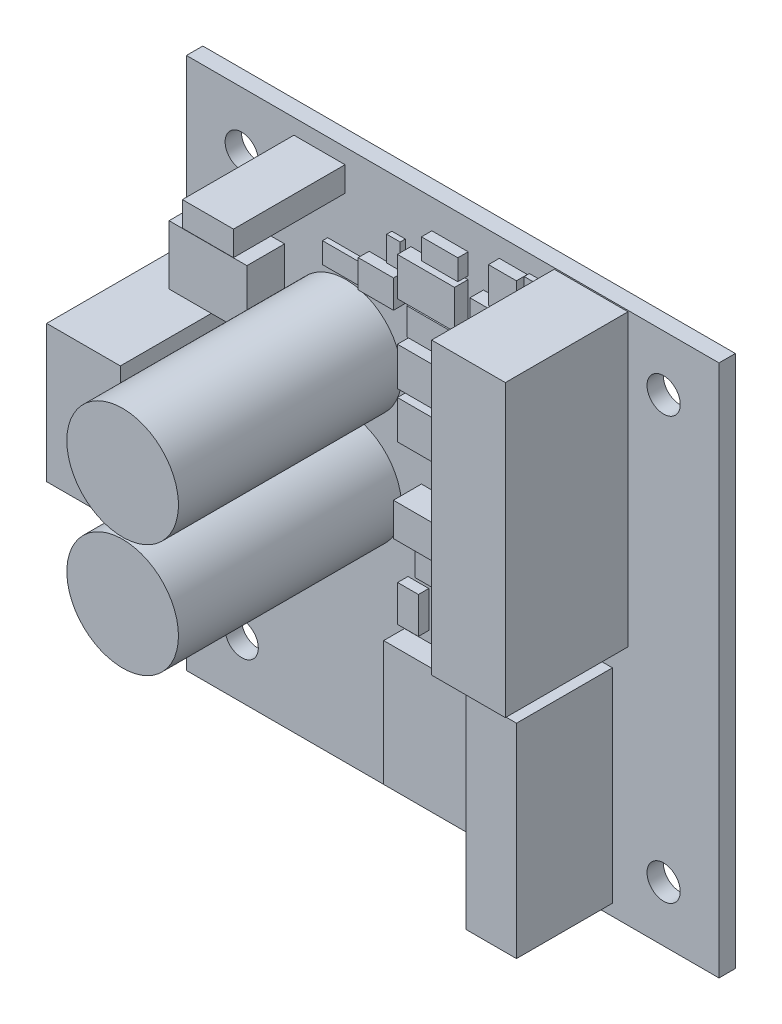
SolidWorks part; units mm, degrees
ref_plane "Front Plane" through (0, 0, 0) normal (0, 0, 1) x (1, 0, 0)
ref_plane "Top Plane" through (0, 0, 0) normal (0, 1, 0) x (1, 0, 0)
ref_plane "Right Plane" through (0, 0, 0) normal (1, 0, 0) x (0, 0, -1)
imported_body "10020689ra1_valve_actuator-1-surface1" [suppressed]
imported_body "MOLEX_705434PIN_705430003-1-surface1" [suppressed]
imported_body "MOLEX_705434PIN_705430003-2-surface1"
imported_body "RESC3225X60N_CRCW121051R0JNEA-1-surface1"
imported_body "TE_872242PIN_872242_SYMMOD1-1-surface1"
imported_body "TE_872242PIN_872242_SYMMOD1-2-surface1"
imported_body "SOIC127P594X3638N_HCPL0701-1-surface1"
imported_body "RESC2012X50N_CRCW0805100RJNEA-1-surface1"
imported_body "RESC2012X50N_CRCW0805100RJNEA-2-surface1"
imported_body "RESC2012X50N_CRCW0805100RJNEA-3-surface1"
imported_body "SOT65P205X1053N_132_BSS138W7F-1-surface1"
imported_body "SOT65P205X1053N_132_BSS138W7F-2-surface1"
imported_body "SOT65P205X1053N_132_BSS138W7F-3-surface1"
imported_body "SOP50P310X908N_SN74AUP1G74DCUR-1-surface1"
imported_body "SOP65P400X1308N_SN74AUP1G99DCTR_SYMMOD2-1-surface1"
imported_body "SOP65P400X1308N_SN74AUP1G99DCTR_SYMMOD2-2-surface1"
imported_body "SOP65P400X1308N_SN74AUP1G99DCTR_SYMMOD2-3-surface1"
imported_body "SOP65P400X1308N_SN74AUP1G99DCTR_SYMMOD3-1-surface1"
imported_body "SOP65P400X1308N_SN74AUP1G99DCTR_SYMMOD1-1-surface1"
imported_body "SOT65P280X1008N_LTC2934ITS81#TRMPBF-1-surface1"
imported_body "SOT65P280X1008N_LT3008ETS833#TRMPBF-1-surface1"
imported_body "DIOM5336X262N_SMBJ22A13F-1-surface1"
imported_body "DIOM5336X262N_SMBJ50A13F-1-surface1"
imported_body "DIOM5336X262N_SMBJ50A13F-2-surface1"
imported_body "CAPC1608X87N_C0603C104K5RAC-1-surface1"
imported_body "CAPC1608X87N_C0603C104K5RAC-2-surface1"
imported_body "CAPC1608X87N_C0603C104K5RAC-3-surface1"
imported_body "CAPC1608X87N_C0603C104K5RAC-4-surface1"
imported_body "SOT95P280X1005N_LT6003HS5#TRMPBF-1-surface1"
imported_body "CAPC2012X100N_C0805C105K4RAC-1-surface1"
imported_body "CAPC2012X100N_C0805C105K4RAC-2-surface1"
imported_body "CAPC2012X100N_C0805C105K4RAC-3-surface1"
imported_body "CAPC2012X100N_C0805C105K4RAC-4-surface1"
imported_body "CAPC2012X100N_C0805C105K4RAC-5-surface1"
imported_body "SOT92P240X120R3N_ACX_BAS197F-1-surface1"
imported_body "SOT92P240X120R3N_ACX_BAS197F-2-surface1"
imported_body "SOT92P240X120R3N_ACX_ZLLS1000TA-1-surface1"
imported_body "IND_MSS6132_MSS6132183MLB-1-surface1"
imported_body "CAPC2012X110N_C0805C474K5RAC-1-surface1"
imported_body "RESC1608X50N_CRCW060336K0JNEA-1-surface1"
imported_body "RESC1608X50N_CRCW060336K0JNEA-2-surface1"
imported_body "RESC1608X50N_CRCW060336K0JNEA-3-surface1"
imported_body "RESC1608X50N_CRCW0603330KJNEA-1-surface1"
imported_body "RESC1608X50N_CRCW06031M00JNEA-1-surface1"
imported_body "RESC1608X50N_CRCW060310K0JNEA-1-surface1"
imported_body "RESC1608X50N_CRCW060310K0JNEA-2-surface1"
imported_body "RESC1608X50N_CRCW0603154KFKEA-1-surface1"
imported_body "RESC1608X50N_CRCW06031M00FKEA-1-surface1"
imported_body "RESC1608X50N_CRCW06031M00FKEA-2-surface1"
imported_body "RESC1608X50N_CRCW06031M00FKEA-3-surface1"
imported_body "RESC1608X50N_CRCW06031M00FKEA-4-surface1"
imported_body "RESC1608X50N_CRCW060342K2FKEA-1-surface1"
imported_body "RESC1608X50N_CRCW06030000Z0EA-1-surface1"
imported_body "RESC1608X50N_CRCW0603100RJNEA-1-surface1"
imported_body "RESC1608X50N_CRCW0603562KFKEA-1-surface1"
imported_body "RESC1608X50N_CRCW060335K7FKEA-1-surface1"
imported_body "SOP50P490X11011N_MSEG_LT3991EMSE5#PBF-1-surface1"
imported_body "DIOM5336X250N_S1AB13F-1-surface1"
imported_body "IND_ACM4520_ACM45209012PT000-1-surface1"
imported_body "CAPC3325X270N_C1210X475K5RACTU-1-surface1"
imported_body "CAPC3325X270N_C1210X475K5RACTU-2-surface1"
imported_body "CAPC3325X270N_C1210X475K5RACTU-3-surface1"
imported_body "INDC1608X95N_MMZ1608S601A-1-surface1"
imported_body "CAPPRD500W60D1000H2150P_ESHSR0005C0002R7-1-surface1"
imported_body "CAPPRD500W60D1000H2150P_ESHSR0005C0002R7-2-surface1"
imported_body "TO127P1054X2008N_BD6212HFPTR-1-surface1"
imported_body "MOLEX_7054310PIN_0705430009-1-surface1"
imported_body "TE_14450945PIN_214450945-1-surface1"
imported_body "SOT95P280X1453N_132_SL353LT-1-surface1" [suppressed]
imported_body "SOT95P280X1453N_132_SL353LT-2-surface1" [suppressed]
sketch "Sketch3" plane through (0, 0, 0) normal (0, 0, 1) x (1, 0, 0)
  line L0 (28.956, 15.9893) -> (28.956, 0)
  line L1 (28.956, 0) -> (0, 0)
  line L16 (9.1313, 25.908) -> (9.1313, 41.783)
  line L17 (9.1313, 41.783) -> (0, 41.783)
  line L18 (0, 41.783) -> (0, 0)
  line L23 (28.956, 15.9893) -> (19.05, 15.9893)
  circle A1 centre (4.6736, 13.9954) radius 1.6002
  arc A2 (9.1313, 25.908) -> (19.05, 15.9893) centre (19.05, 25.908) ccw
  circle A4 centre (4.6736, 37.8206) radius 1.6002
  circle A9 centre (22.225, 2.667) radius 0.5461
  circle A10 centre (19.685, 2.667) radius 0.5461
  circle A11 centre (17.145, 2.667) radius 0.5461
  circle A12 centre (14.605, 2.667) radius 0.5461
extrude "Boss-Extrude2" [suppressed] add sketch "Sketch3" along normal blind 1.5748
sketch "Sketch4" plane through (0, 0, 0) normal (0, 0, 1) x (1, 0, 0)
  line L1 (28.9687, 51.308) -> (80.264, 51.308)
  line L2 (28.9687, 51.308) -> (28.9687, 0)
  line L3 (28.9687, 0) -> (80.264, 0)
  line L4 (80.264, 51.308) -> (80.264, 0)
  circle A33 centre (74.93, 45.974) radius 1.6002
  circle A34 centre (67.183, 48.641) radius 0.5461
  circle A35 centre (67.183, 46.101) radius 0.5461
  circle A36 centre (67.183, 43.561) radius 0.5461
  circle A37 centre (67.183, 41.021) radius 0.5461
  circle A38 centre (67.183, 38.481) radius 0.5461
  circle A39 centre (67.183, 35.941) radius 0.5461
  circle A40 centre (67.183, 33.401) radius 0.5461
  circle A41 centre (67.183, 30.861) radius 0.5461
  circle A42 centre (67.183, 28.321) radius 0.5461
  circle A43 centre (67.183, 25.781) radius 0.5461
  circle A44 centre (67.818, 19.1364) radius 1.2065
  circle A45 centre (67.818, 16.9215) radius 0.5334
  circle A46 centre (67.818, 13.9217) radius 0.5334
  circle A47 centre (67.818, 10.922) radius 0.5334
  circle A48 centre (67.818, 7.9223) radius 0.5334
  circle A49 centre (67.818, 4.9225) radius 0.5334
  circle A50 centre (67.818, 2.7076) radius 1.2065
  circle A51 centre (74.93, 5.334) radius 1.6002
  circle A52 centre (34.29, 5.334) radius 1.6002
  circle A53 centre (32.004, 11.938) radius 0.4826
  circle A54 centre (32.004, 14.478) radius 0.4826
  circle A55 centre (31.623, 23.622) radius 0.5461
  circle A56 centre (31.623, 26.162) radius 0.5461
  circle A57 centre (31.623, 28.702) radius 0.5461
  circle A58 centre (31.623, 31.242) radius 0.5461
  circle A59 centre (41.8236, 34.925) radius 0.4318
  circle A60 centre (46.8224, 34.925) radius 0.4318
  circle A61 centre (46.8224, 24.003) radius 0.4318
  circle A62 centre (41.8236, 24.003) radius 0.4318
  circle A63 centre (34.29, 45.974) radius 1.6002
  circle A64 centre (40.513, 48.641) radius 0.4826
  circle A65 centre (43.053, 48.641) radius 0.4826
extrude "Boss-Extrude3" add sketch "Sketch4" along normal blind 1.5748
